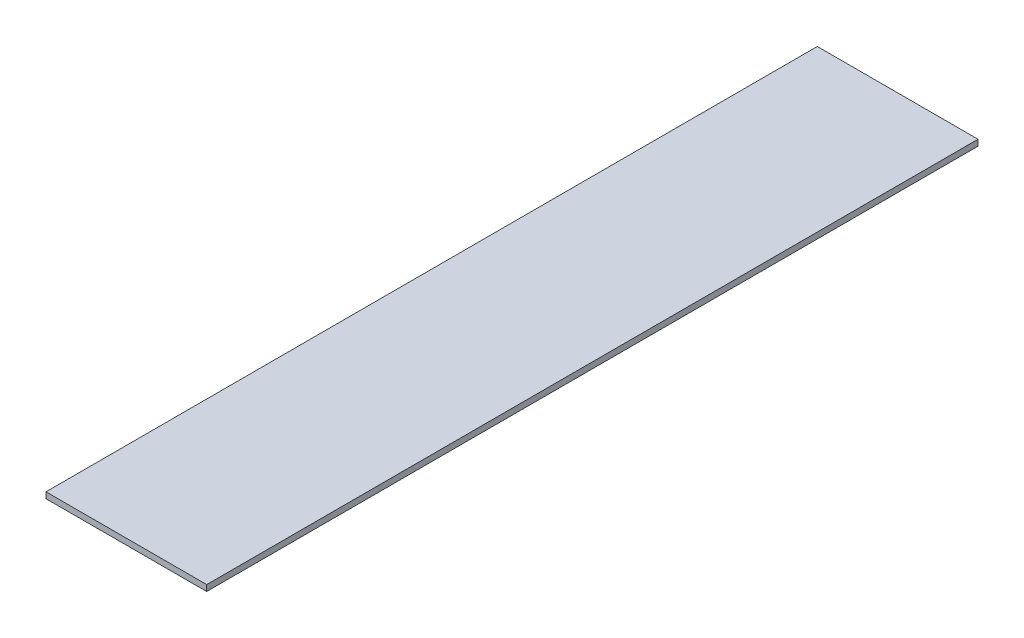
SolidWorks part; units mm, degrees
ref_plane "Front Plane" through (0, 0, 0) normal (0, 0, 1) x (1, 0, 0)
ref_plane "Top Plane" through (0, 0, 0) normal (0, 1, 0) x (1, 0, 0)
ref_plane "Right Plane" through (0, 0, 0) normal (1, 0, 0) x (0, 0, -1)
sketch "Sketch1" plane through (0, 0, 0) normal (0, 1, 0) x (1, 0, 0)
  line L1 (0, 0) -> (127, 0)
  line L2 (0, 0) -> (0, 609.6)
  line L3 (0, 609.6) -> (127, 609.6)
  line L4 (127, 0) -> (127, 609.6)
  dimension "D1" = 127
  dimension "D2" = 609.6
extrude "Boss-Extrude1" add sketch "Sketch1" along normal blind 4.7625
sketch "Sketch2" plane through (0, 0, 0) normal (0, 0, 1) x (1, 0, 0)
  line L0 (0, 4.7625) -> (127, 4.7625) construction
  line L1 (2.54, 4.445) -> (7.62, 4.445)
  line L2 (2.54, 4.445) -> (2.54, 0.3175)
  line L3 (2.54, 0.3175) -> (7.62, 0.3175)
  line L4 (7.62, 4.445) -> (7.62, 0.3175)
  line L5 (0, 0) -> (127, 0) construction
  line L8 (0, 4.7625) -> (0, 0) construction
  dimension "D1" = 0.3175
  dimension "D2" = 0.3175
  dimension "D3" = 2.54
  dimension "D4" = 5.08
extrude "Cut-Extrude3" [suppressed] cut sketch "Sketch2" against normal through all
pattern_linear "LPattern1" [suppressed] count 23 spacing 5.3975 count 2 spacing 5.3975
